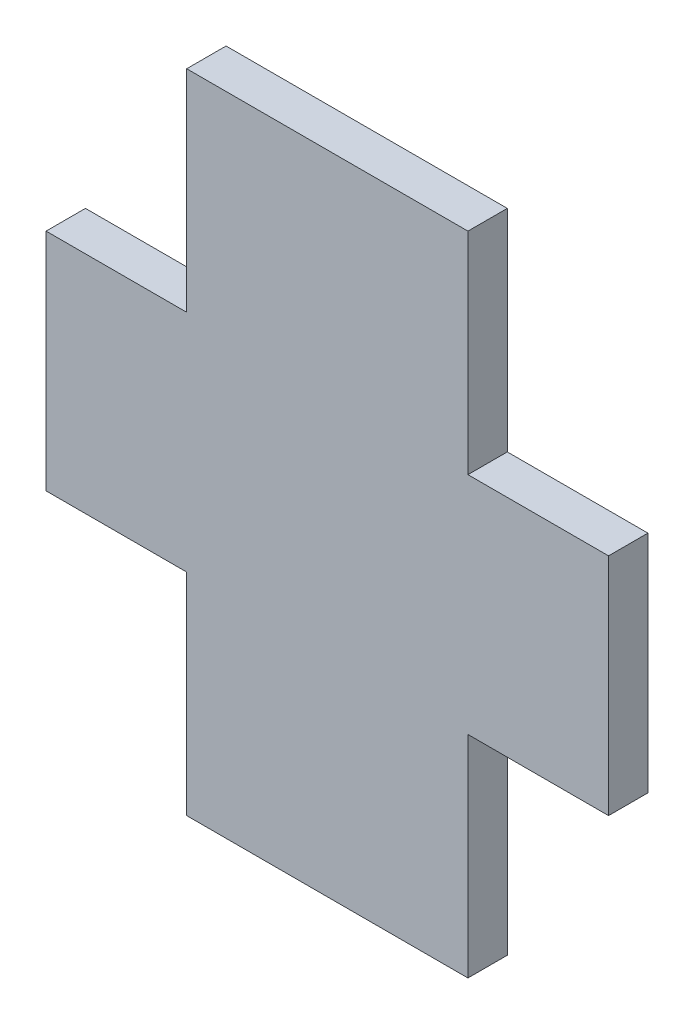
SolidWorks part; units mm, degrees
ref_plane "Alzado" through (0, 0, 0) normal (0, 0, 1) x (1, 0, 0)
ref_plane "Planta" through (0, 0, 0) normal (0, 1, 0) x (1, 0, 0)
ref_plane "Vista lateral" through (0, 0, 0) normal (1, 0, 0) x (0, 0, -1)
sketch "Croquis1" plane through (0, 0, 0) normal (0, 0, 1) x (1, 0, 0)
  line L0 (-10, 8) -> (-10, 23)
  line L1 (20, -8) -> (10, -8)
  line L2 (20, -8) -> (20, 8)
  line L3 (20, 8) -> (10, 8)
  line L4 (-20, -8) -> (-20, 8)
  line L5 (20, -8) -> (-20, 8) construction
  line L6 (20, 8) -> (-20, -8) construction
  line L7 (-10, 23) -> (10, 23)
  line L8 (10, 23) -> (10, 8)
  line L9 (10, -8) -> (10, -23)
  line L10 (10, -23) -> (-10, -23)
  line L11 (-10, -23) -> (-10, -8)
  line L12 (-10, 8) -> (-20, 8)
  line L13 (-10, -8) -> (-20, -8)
  point P0 (0, 0)
  point P12 (0, 0)
  point P15 (0, 23)
  point P16 (0, -23)
  point P17 (-20, 0)
  point P18 (20, 0)
  dimension "D1" = 16
  dimension "D2" = 40
  dimension "D3" = 20
  dimension "D4" = 20
  dimension "D5" = 15
  dimension "D6" = 15
extrude "Saliente-Extruir1" add sketch "Croquis1" along normal blind 2.8
